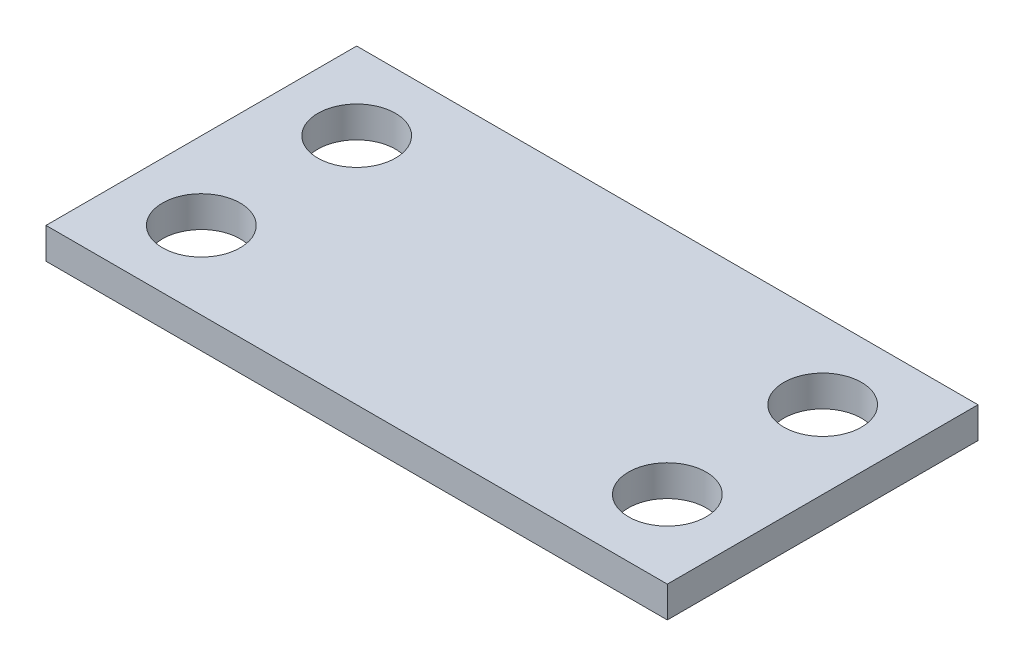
SolidWorks part; units mm, degrees
ref_plane "Front Plane" through (0, 0, 0) normal (0, 0, 1) x (1, 0, 0)
ref_plane "Top Plane" through (0, 0, 0) normal (0, 1, 0) x (1, 0, 0)
ref_plane "Right Plane" through (0, 0, 0) normal (1, 0, 0) x (0, 0, -1)
sketch "Sketch1" plane through (0, 0, 0) normal (0, 1, 0) x (1, 0, 0)
  line L0 (-40, 20) -> (-40, -20)
  line L1 (-40, -20) -> (40, -20)
  line L2 (40, -20) -> (40, 20)
  line L3 (40, 20) -> (-40, 20)
  line L4 (0, 20) -> (0, 0) construction
  line L5 (0, 0) -> (40, 0) construction
  dimension "D1" = 80
  dimension "D2" = 40
extrude "Boss-Extrude1" add sketch "Sketch1" along normal blind 4
sketch "Sketch2" plane through (0, 4, 0) normal (0, 1, 0) x (1, 0, 0)
  line L1 (-40, 20) -> (-40, -20) construction
  line L3 (40, 20) -> (-40, 20) construction
  line L4 (-40, -20) -> (40, -20) construction
  circle A0 centre (-30, 10) radius 5
  circle A1 centre (-30, -10) radius 5
  circle A2 centre (30, -10) radius 5
  circle A3 centre (30, 10) radius 5
  dimension "D4" = 10
  dimension "D1" = 60
  dimension "D2" = 10
  dimension "D3" = 10
  dimension "D5" = 10
extrude "Cut-Extrude1" cut sketch "Sketch2" against normal through all
